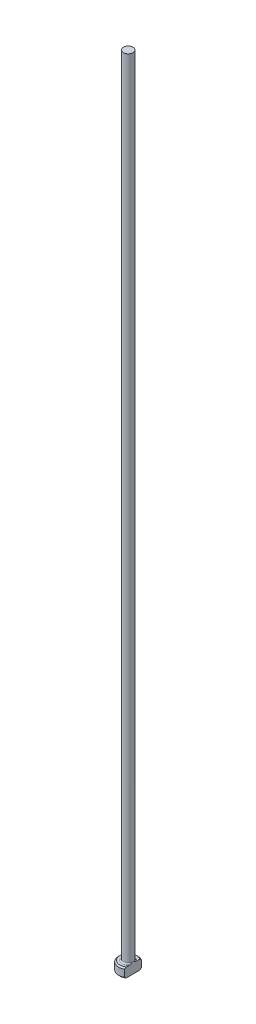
SolidWorks part; units mm, degrees
ref_plane "Front Plane" through (0, 0, 0) normal (0, 0, 1) x (1, 0, 0)
ref_plane "Top Plane" through (0, 0, 0) normal (0, 1, 0) x (1, 0, 0)
ref_plane "Right Plane" through (0, 0, 0) normal (1, 0, 0) x (0, 0, -1)
sketch "Sketch1" plane through (0, 0, 0) normal (0, 0, 1) x (1, 0, 0)
  line L0 (0, 259.9588) -> (0, -15.1925) construction
  line L1 (0, 0) -> (-1.5, 0)
  line L2 (-1.5, 0) -> (-1.5, 1.5)
  line L3 (-1.5, 1.5) -> (-0.75, 1.5)
  line L4 (-0.75, 1.5) -> (-0.75, 125)
  line L5 (-0.75, 125) -> (0, 125)
  line L6 (0, 125) -> (0, 0)
  dimension "L" = 125
  dimension "H" = 3
  dimension "T" = 1.5
  dimension "D" = 1.5
revolve "Revolve1" add sketch "Sketch1" angle 360 about L0
chamfer "Chamfer1" distance 0.2 angle 45 2 edges at (0, 1.5, 1.5) (0, 0, 1.5)
fillet "Fillet1" radius 0.2 1 edges at (0, 1.5, 0.75)
sketch "Sketch2" plane through (0, 0, 0) normal (0, 1, 0) x (1, 0, 0)
  line L0 (0.75, 1.299) -> (0.75, -1.299)
  circle A0 centre (0, 0) radius 1.5 construction
  arc A1 (0.75, -1.299) -> (0.75, 1.299) centre (0, 0) ccw
  circle A2 centre (0, 0) radius 0.75 construction
extrude "KEY" cut sketch "Sketch2" along normal through all
